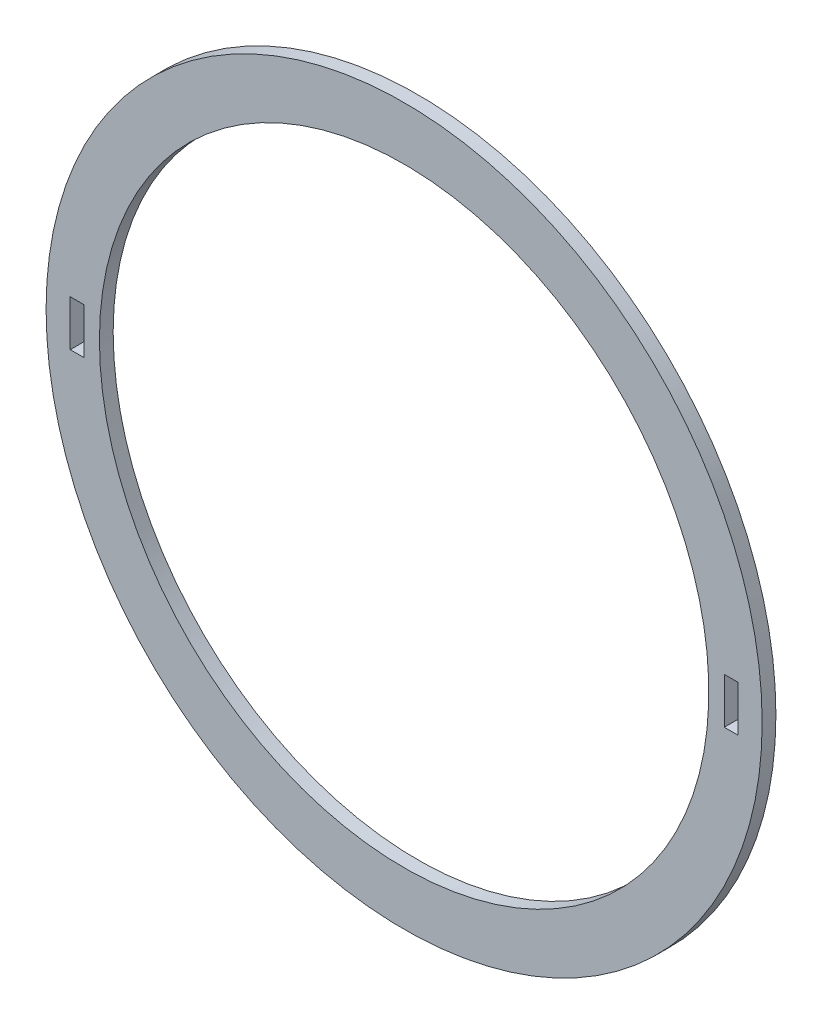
SolidWorks part; units mm, degrees
ref_plane "Front Plane" through (0, 0, 0) normal (0, 0, 1) x (1, 0, 0)
ref_plane "Top Plane" through (0, 0, 0) normal (0, 1, 0) x (1, 0, 0)
ref_plane "Right Plane" through (0, 0, 0) normal (1, 0, 0) x (0, 0, -1)
sketch "Sketch1" plane through (0, 0, 0) normal (0, 0, 1) x (1, 0, 0)
  line L0 (0, -14.5463) -> (0, -47.8909) construction
  line L1 (37.0095, 22.6012) -> (35.4855, 22.6012)
  line L2 (37.0095, 27.6812) -> (35.4855, 27.6812)
  line L3 (35.4855, 27.6812) -> (35.4855, 22.6012)
  line L4 (-37.0095, 27.6812) -> (-37.0095, 22.6012)
  line L5 (-35.4855, 27.6812) -> (-35.4855, 22.6012)
  line L6 (-37.0095, 27.6812) -> (-35.4855, 27.6812)
  line L7 (-37.0095, 22.6012) -> (-35.4855, 22.6012)
  line L8 (37.0095, 27.6812) -> (37.0095, 22.6012)
  circle A0 centre (0, 25.1412) radius 39.6875
  circle A1 centre (0, 25.1412) radius 33.7769
  dimension "D1" = 79.375
extrude "Boss-Extrude1" add sketch "Sketch1" along normal blind 1.524
